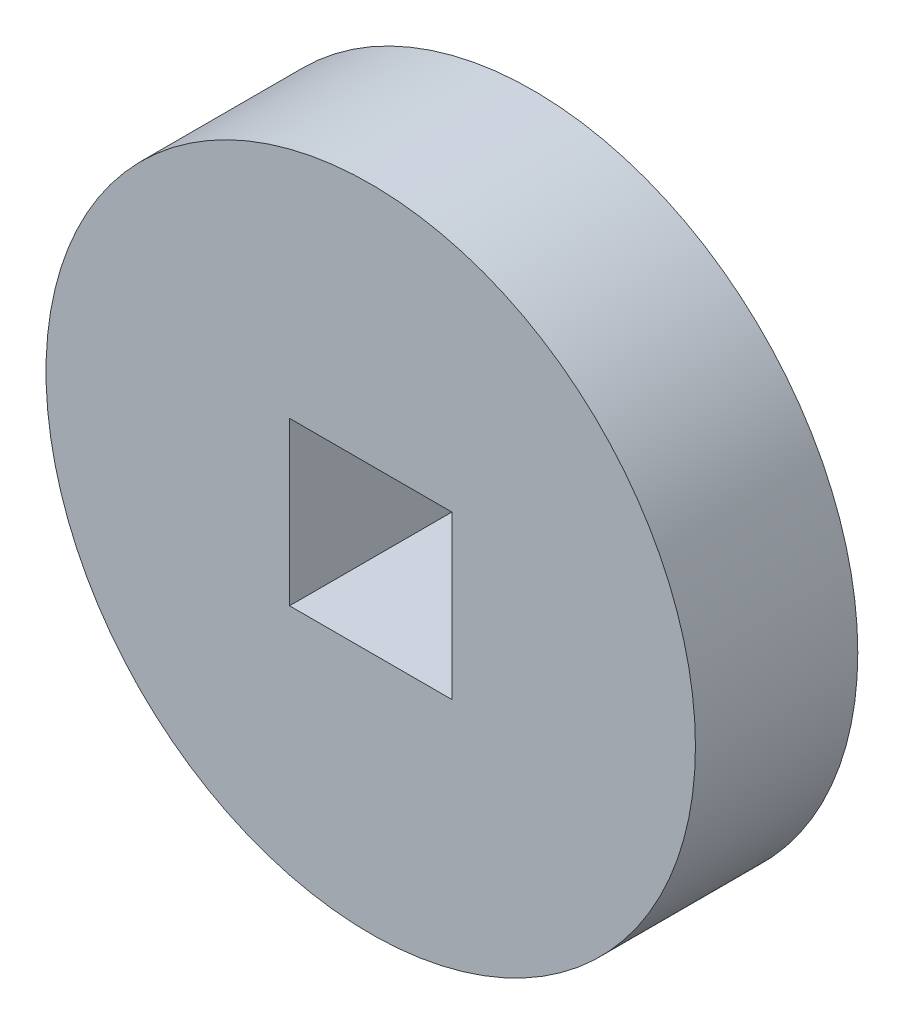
SolidWorks part; units mm, degrees
ref_plane "Front Plane" through (0, 0, 0) normal (0, 0, 1) x (1, 0, 0)
ref_plane "Top Plane" through (0, 0, 0) normal (0, 1, 0) x (1, 0, 0)
ref_plane "Right Plane" through (0, 0, 0) normal (1, 0, 0) x (0, 0, -1)
sketch "Sketch1" plane through (0, 0, 0) normal (0, 0, 1) x (1, 0, 0)
  line L1 (-3.175, 3.175) -> (3.175, 3.175)
  line L2 (-3.175, 3.175) -> (-3.175, -3.175)
  line L3 (-3.175, -3.175) -> (3.175, -3.175)
  line L4 (3.175, 3.175) -> (3.175, -3.175)
  line L5 (-3.175, 3.175) -> (3.175, -3.175) construction
  line L6 (-3.175, -3.175) -> (3.175, 3.175) construction
  circle A0 centre (0, 0) radius 12.7
  dimension "D1" = 25.4
  dimension "D2" = 6.35
  dimension "D3" = 6.35
extrude "Boss-Extrude1" add sketch "Sketch1" along normal blind 6.35
